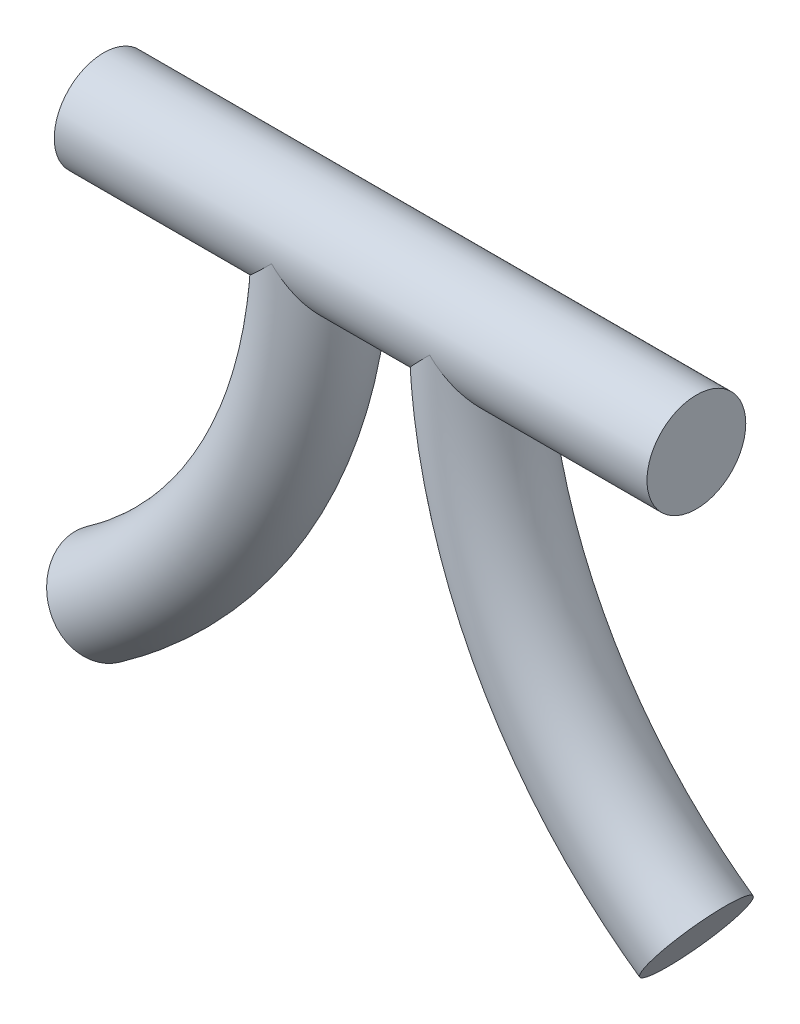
SolidWorks part; units mm, degrees
ref_plane "前视基准面" through (0, 0, 0) normal (0, 0, 1) x (1, 0, 0)
ref_plane "上视基准面" through (0, 0, 0) normal (0, 1, 0) x (1, 0, 0)
ref_plane "右视基准面" through (0, 0, 0) normal (1, 0, 0) x (0, 0, -1)
other "Configuration Table"
sketch "草图1" plane through (0, 0, 0) normal (1, 0, 0) x (0, 0, -1)
  circle A0 centre (0, 0) radius 25
  dimension "D1" = 50
extrude "凸台-拉伸1" add sketch "草图1" against normal mid plane 300
sketch "草图2" plane through (0, 0, 0) normal (0, 0, 1) x (1, 0, 0)
  line L0 (-150, 25) -> (-150, -25) construction
  line L1 (-267.6122, 0) -> (206.8397, 0) construction
  arc A0 (-40, 0) -> (-150, -212.3676) centre (-300, 0) cw
  point P5 (0, 0)
  point P7 (0, 0)
  point P8 (-301.7301, 0)
  dimension "D1" = 40
  dimension "D2" = 300
sweep "扫描1" add path "草图2" parameters "D3"=50
mirror "镜向1" about plane through (0, 0, 0) normal (1, 0, 0) of "扫描1"
